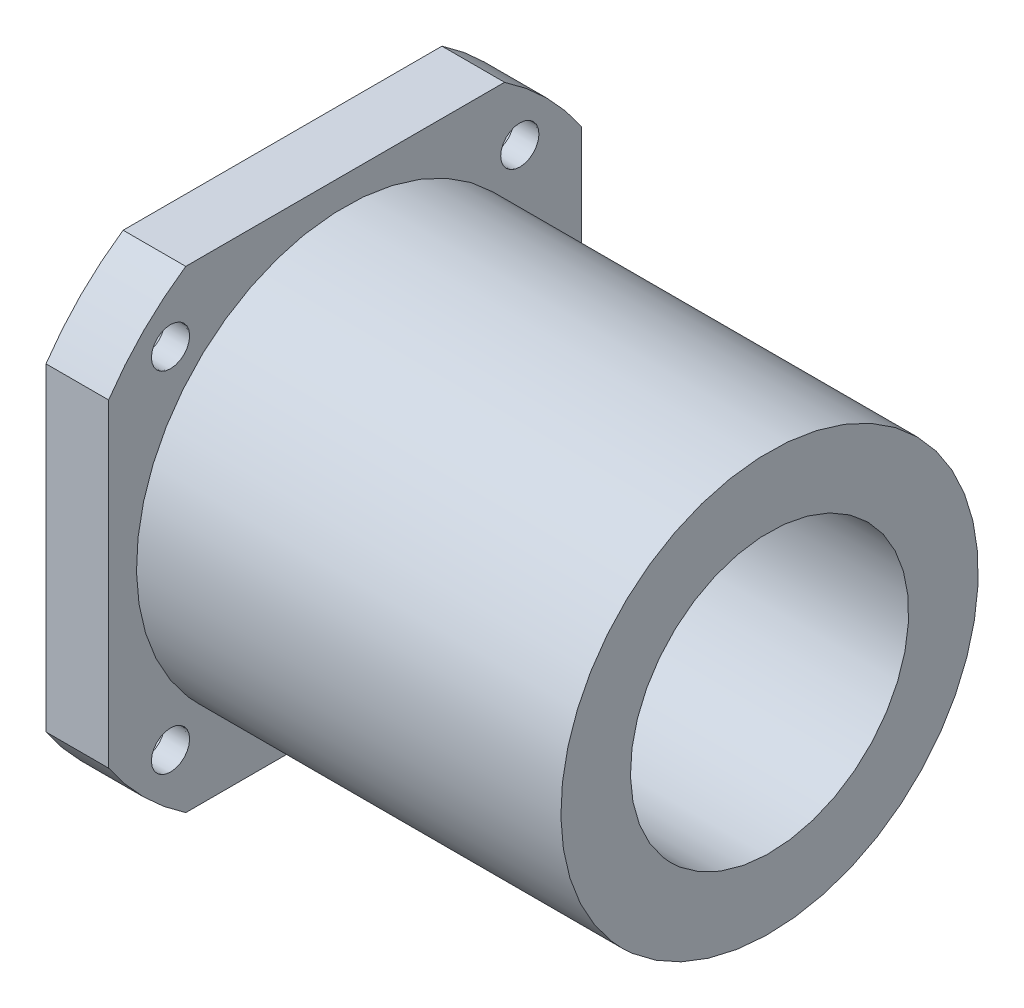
SolidWorks part; units mm, degrees
other "Solid1"
ref_plane "Front Plane" through (0, 0, 0) normal (0, 0, 1) x (1, 0, 0)
ref_plane "Top Plane" through (0, 0, 0) normal (0, 1, 0) x (1, 0, 0)
ref_plane "Right Plane" through (0, 0, 0) normal (1, 0, 0) x (0, 0, -1)
imported_body "2.7057 LMK80UU.stp<1>"
move or copy body "Body-Move/Copy1" bodies to move or copy 101 copy no rotation origin (0, 0, 0) rotation axis (1, 0, 0) rotation angle 45
